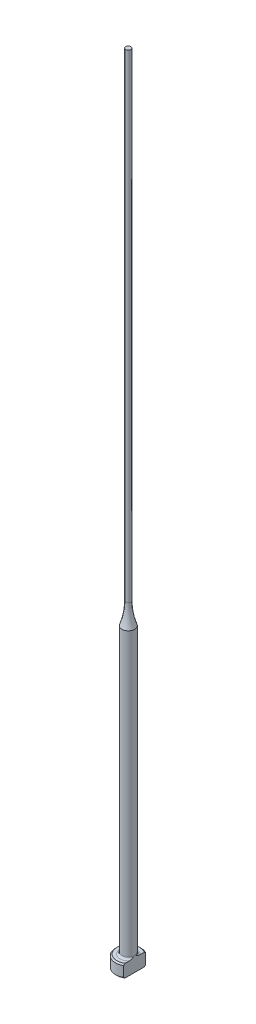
SolidWorks part; units mm, degrees
ref_plane "Front Plane" through (0, 0, 0) normal (0, 0, 1) x (1, 0, 0)
ref_plane "Top Plane" through (0, 0, 0) normal (0, 1, 0) x (1, 0, 0)
ref_plane "Right Plane" through (0, 0, 0) normal (1, 0, 0) x (0, 0, -1)
sketch "Sketch1" plane through (0, 0, 0) normal (0, 0, 1) x (1, 0, 0)
  line L0 (0, 259.9588) -> (0, -15.1925) construction
  line L1 (0, 0) -> (-2, 0)
  line L2 (-2, 0) -> (-2, 2)
  line L3 (-2, 2) -> (-1, 2)
  line L4 (-0.4, 50) -> (-0.4, 125)
  line L5 (-0.4, 125) -> (0, 125)
  line L6 (0, 125) -> (0, 0)
  line L7 (-1, 2) -> (-1, 46.5883)
  arc A0 (-1, 46.5883) -> (-0.4, 50) centre (-10.4, 50) ccw
  point P13 (-1, 0)
  dimension "D1" = 10
  dimension "L" = 125
  dimension "H" = 4
  dimension "T" = 2
  dimension "D" = 0.8
  dimension "B" = 2
  dimension "S" = 50
revolve "Revolve1" add sketch "Sketch1" angle 360 about L0
chamfer "Chamfer1" distance 0.2 angle 45 2 edges at (0, 2, 2) (0, 0, 2)
fillet "Fillet1" radius 0.3 1 edges at (0, 2, 1)
sketch "Sketch2" plane through (0, 0, 0) normal (0, 1, 0) x (1, 0, 0)
  line L0 (1, 1.7321) -> (1, -1.7321)
  circle A0 centre (0, 0) radius 2 construction
  arc A1 (1, -1.7321) -> (1, 1.7321) centre (0, 0) ccw
  circle A2 centre (0, 0) radius 1 construction
extrude "KEY" cut sketch "Sketch2" along normal through all
